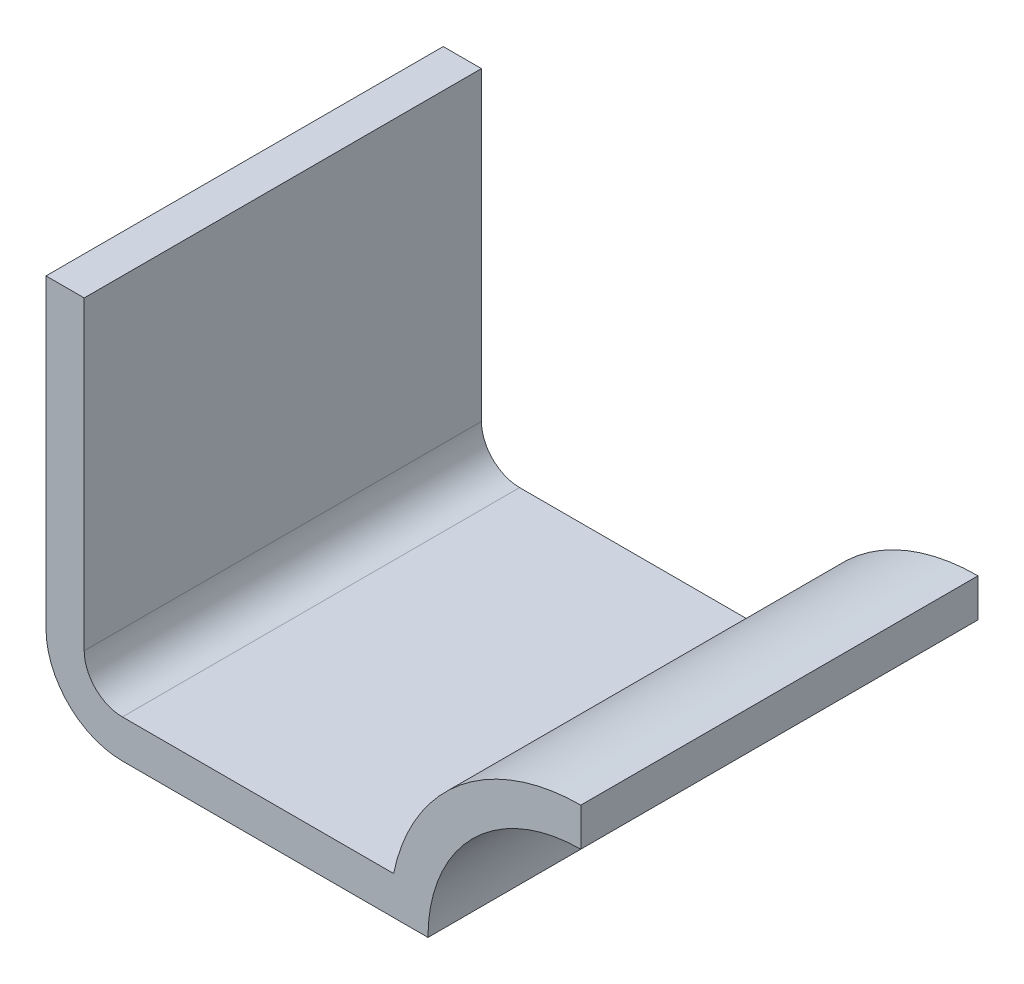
SolidWorks part; units mm, degrees
ref_plane "Front Plane" through (0, 0, 0) normal (0, 0, 1) x (1, 0, 0)
ref_plane "Top Plane" through (0, 0, 0) normal (0, 1, 0) x (1, 0, 0)
ref_plane "Right Plane" through (0, 0, 0) normal (1, 0, 0) x (0, 0, -1)
sketch "Sketch1" plane through (0, 0, 0) normal (0, 0, 1) x (1, 0, 0)
  line L0 (0, 0) -> (50, 0)
  line L1 (0, 0) -> (0, 50)
  arc A0 (50, 0) -> (70, 20) centre (70, 0) cw
  point P8 (0, 0)
  dimension "D1" = 50
  dimension "D3" = 20
  dimension "D2" = 50
extrude "Extrude-Thin1" add sketch "Sketch1" along normal mid plane 52 thin
